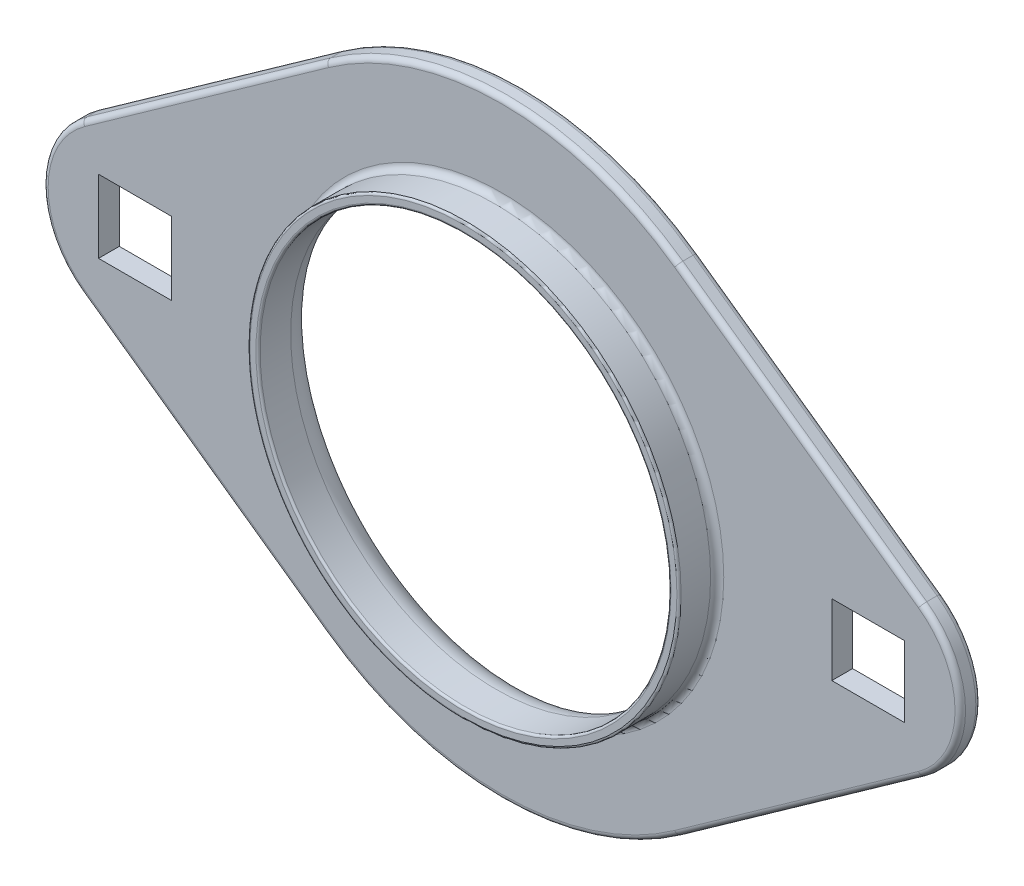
SolidWorks part; units mm, degrees
ref_plane "Front Plane" through (0, 0, 0) normal (0, 0, 1) x (1, 0, 0)
ref_plane "Top Plane" through (0, 0, 0) normal (0, 1, 0) x (1, 0, 0)
ref_plane "Right Plane" through (0, 0, 0) normal (1, 0, 0) x (0, 0, -1)
sketch "Sketch1" plane through (0, 0, 0) normal (0, 0, 1) x (1, 0, 0)
  line L0 (0, 103.4806) -> (0, -103.4806) construction
  line L1 (-38.9179, 0) -> (38.9179, 0) construction
  line L2 (16.9993, 23.9567) -> (40.5433, 7.2502)
  line L3 (16.9993, -23.9567) -> (40.5433, -7.2502)
  line L4 (-16.9993, -23.9567) -> (-40.5433, -7.2502)
  line L5 (-16.9993, 23.9567) -> (-40.5433, 7.2502)
  line L6 (-38.9179, 3.5179) -> (-31.8821, 3.5179)
  line L7 (-38.9179, 3.5179) -> (-38.9179, -3.5179)
  line L8 (-38.9179, -3.5179) -> (-31.8821, -3.5179)
  line L9 (-31.8821, 3.5179) -> (-31.8821, -3.5179)
  line L10 (31.8821, 3.4239) -> (38.9179, 3.4239)
  line L11 (31.8821, 3.4239) -> (31.8821, -3.4239)
  line L12 (31.8821, -3.4239) -> (38.9179, -3.4239)
  line L13 (38.9179, 3.4239) -> (38.9179, -3.4239)
  arc A0 (16.9993, 23.9567) -> (-16.9993, 23.9567) centre (0, 0) ccw
  circle A1 centre (0, 0) radius 19.8374
  arc A2 (40.5433, 7.2502) -> (40.5433, -7.2502) centre (35.3987, 0) cw
  arc A3 (16.9993, -23.9567) -> (-16.9993, -23.9567) centre (0, 0) cw
  arc A4 (-40.5433, 7.2502) -> (-40.5433, -7.2502) centre (-35.3987, 0) ccw
  dimension "D1" = 29.3751
  dimension "D2" = 39.6748
  dimension "D3" = 8.89
  dimension "D4" = 70.7974
  dimension "D5" = 7.0358
  dimension "D6" = 38.9179
  dimension "D7" = 6.8478
extrude "Extrude1" add sketch "Sketch1" along normal mid plane 2.0066
sketch "Sketch2" plane through (0, 0, 1.0033) normal (0, 0, 1) x (1, 0, 0)
  circle A0 centre (0, 0) radius 20.8153
  circle A1 centre (0, 0) radius 19.8374 construction
  circle A2 centre (0, 0) radius 19.8374
  dimension "D1" = 41.6306
extrude "Extrude2" add sketch "Sketch2" along normal blind 3.683
fillet "Fillet1" radius 2.54 1 edges at (19.8374, 0, -1.0033)
fillet "Fillet2" radius 0.635 1 edges at (20.8153, 0, 1.0033)
fillet "Fillet3" radius 0.508 16 edges at (28.7713, 15.6034, -1.0033) (44.2887, 0, -1.0033) (28.7713, -15.6034, -1.0033) (0, -29.3751, -1.0033) (-28.7713, -15.6034, -1.0033) (-44.2887, 0, -1.0033) (-28.7713, 15.6034, -1.0033) (28.7713, 15.6034, 1.0033) (44.2887, 0, 1.0033) (28.7713, -15.6034, 1.0033) (0, -29.3751, 1.0033) (-28.7713, -15.6034, 1.0033) (-44.2887, 0, 1.0033) (-28.7713, 15.6034, 1.0033) (0, 29.3751, -1.0033) (0, 29.3751, 1.0033)
fillet "Fillet4" radius 0.2032 2 edges at (20.8153, 0, 4.6863) (19.8374, 0, 4.6863)
